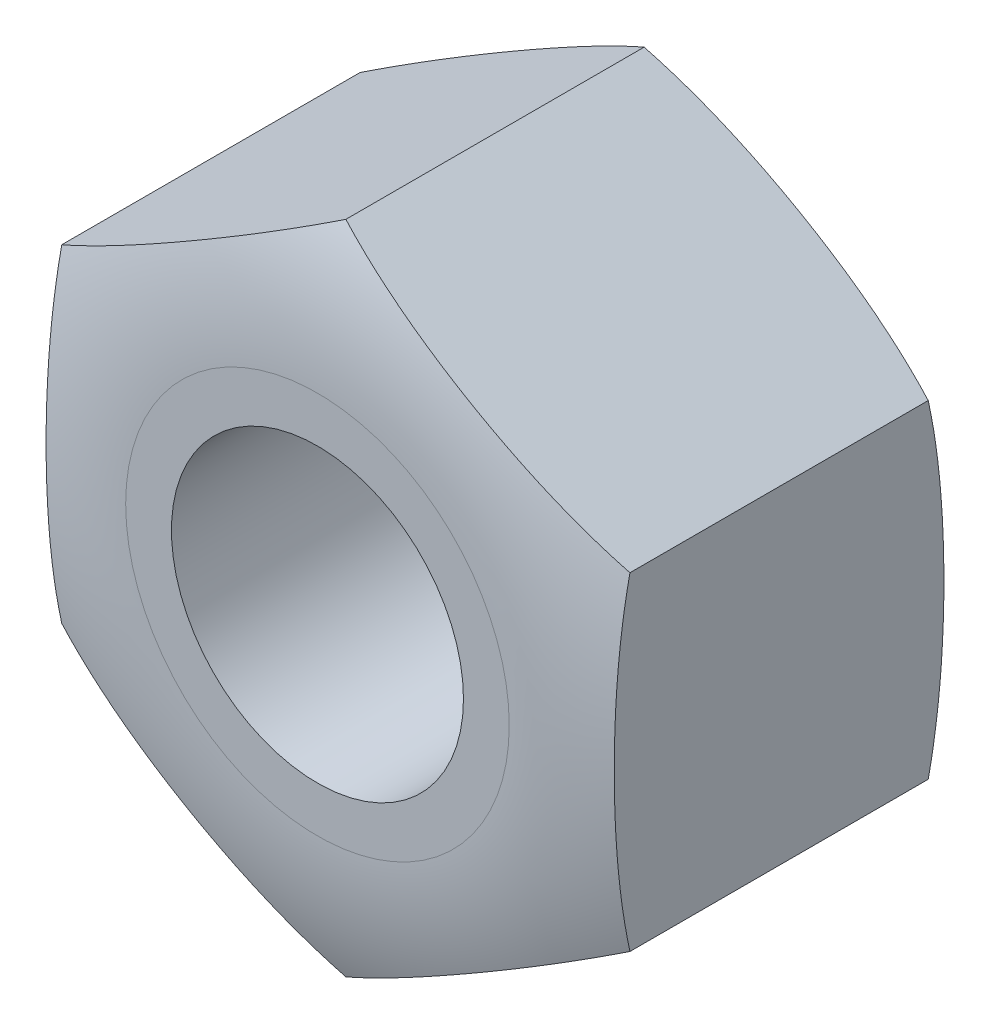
SolidWorks part; units mm, degrees
ref_plane "Front Plane" through (0, 0, 0) normal (0, 0, 1) x (1, 0, 0)
ref_plane "Top Plane" through (0, 0, 0) normal (0, 1, 0) x (1, 0, 0)
ref_plane "Right Plane" through (0, 0, 0) normal (1, 0, 0) x (0, 0, -1)
sketch "Sketch1" plane through (0, 0, 0) normal (0, 0, 1) x (1, 0, 0)
  line L1 (6.35, 3.6662) -> (0, 7.3323)
  line L2 (0, 7.3323) -> (-6.35, 3.6662)
  line L3 (-6.35, 3.6662) -> (-6.35, -3.6662)
  line L4 (-6.35, -3.6662) -> (0, -7.3323)
  line L5 (0, -7.3323) -> (6.35, -3.6662)
  line L6 (6.35, -3.6662) -> (6.35, 3.6662)
  circle A0 centre (0, 0) radius 6.35 construction
  dimension "D1" = 12.7
extrude "Extrude1" add sketch "Sketch1" along normal mid plane 7.9375
hole_wizard "5/16-18 Tapped Hole1" positions "Sketch3" profile "Sketch2" tap size "5/16-18" standard "Example Inch"
sketch "Sketch3" plane through (0, 0, 3.9688) normal (0, 0, 1) x (1, 0, 0)
  point P0 (0, 0)
sketch "Sketch2" plane through (0, 0, 3.9688) normal (1, 0, 0) x (0, -1, 0)
  line L0 (0, 0) -> (0, 7.9375)
  line L1 (0, 7.9375) -> (3.2639, 7.9375)
  line L2 (3.2639, 7.9375) -> (3.2639, 0)
  line L5 (3.2639, 0) -> (0, 0)
  line L11 (0, -6.35) -> (0, 107.95) construction
  dimension "Thru Tap Drill Dia." = 6.5278
  dimension "Thru Tap Drill Depth" = 7.9375
sketch "Sketch4" plane through (0, 0, 0) normal (1, 0, 0) x (0, 0, -1)
  line L0 (-3.9688, 4.287) -> (-3.9688, 7.3323)
  line L1 (-3.9688, 7.3323) -> (-3.3337, 7.3323)
  line L2 (-3.9688, 7.3323) -> (3.9688, 7.3323) construction
  line L3 (-3.9688, 3.6662) -> (-3.9688, 7.3323) construction
  line L4 (0, 0) -> (0, 5.7144) construction
  line L5 (3.9688, 7.3323) -> (3.3337, 7.3323)
  line L6 (3.9688, 4.287) -> (3.9688, 7.3323)
  arc A0 (-3.3337, 7.3323) -> (-3.9688, 4.287) centre (3.6512, 4.287) ccw
  arc A1 (3.3337, 7.3323) -> (3.9688, 4.287) centre (-3.6512, 4.287) cw
  dimension "D2" = 7.62
  dimension "D1" = 0.635
revolve "Cut-Revolve1" cut sketch "Sketch4" angle 360 about axis through (0, 0, 3.9688) along (0, 0, 1)
